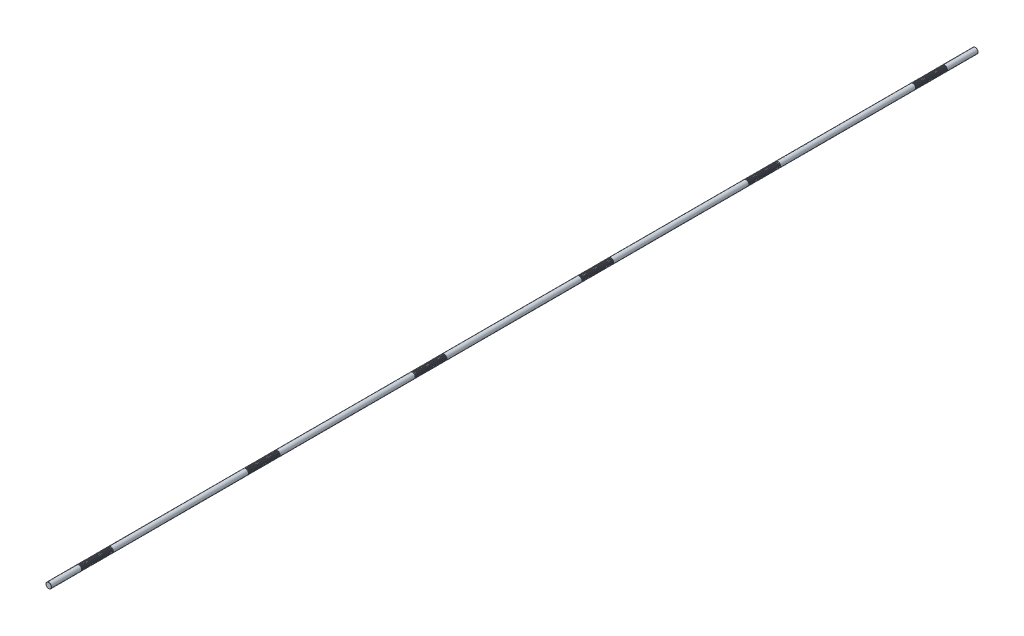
SolidWorks part; units mm, degrees
ref_plane "Front Plane" through (0, 0, 0) normal (0, 0, 1) x (1, 0, 0)
ref_plane "Top Plane" through (0, 0, 0) normal (0, 1, 0) x (1, 0, 0)
ref_plane "Right Plane" through (0, 0, 0) normal (1, 0, 0) x (0, 0, -1)
sketch "Sketch1" plane through (0, 0, 0) normal (0, 0, 1) x (1, 0, 0)
  circle A0 centre (0, 0) radius 9
  dimension "D1" = 18
extrude "Boss-Extrude1" add sketch "Sketch1" along normal mid plane 3000
chamfer "Chamfer1" distance 0.45 angle 45 2 edges at (9, 0, -1500) (9, 0, 1500)
sketch "Sketch2" plane through (0, 0, 0) normal (1, 0, 0) x (0, 0, -1)
  line L0 (1400.3014, 9) -> (1397.6986, 9)
  line L1 (1499.55, 9) -> (-1499.55, 9) construction
  line L2 (1397.6986, 9) -> (1398.3014, 6.75)
  line L3 (1398.3014, 6.75) -> (1399.6986, 6.75)
  line L4 (1399.6986, 6.75) -> (1400.3014, 9)
  line L5 (1500, -8.55) -> (1500, 8.55) construction
  point P4 (1399, 9)
  point P7 (1399, 6.75)
  point P8 (1400, 7.875)
  point P9 (1398, 7.875)
  dimension "D1" = 2
  dimension "D2" = 100
  dimension "D3" = 2.25
  dimension "D4" = 30
revolve "Cut-Revolve1" cut sketch "Sketch2" angle 360 about axis through (0, 0, 1500) along (0, 0, -1)
pattern_linear "LPattern1" count 26 spacing 4 along (0, 0, 1) of "Cut-Revolve1"
pattern_linear "LPattern2" count 6 spacing 540 along (0, 0, 1) of "Cut-Revolve1", "LPattern1"
